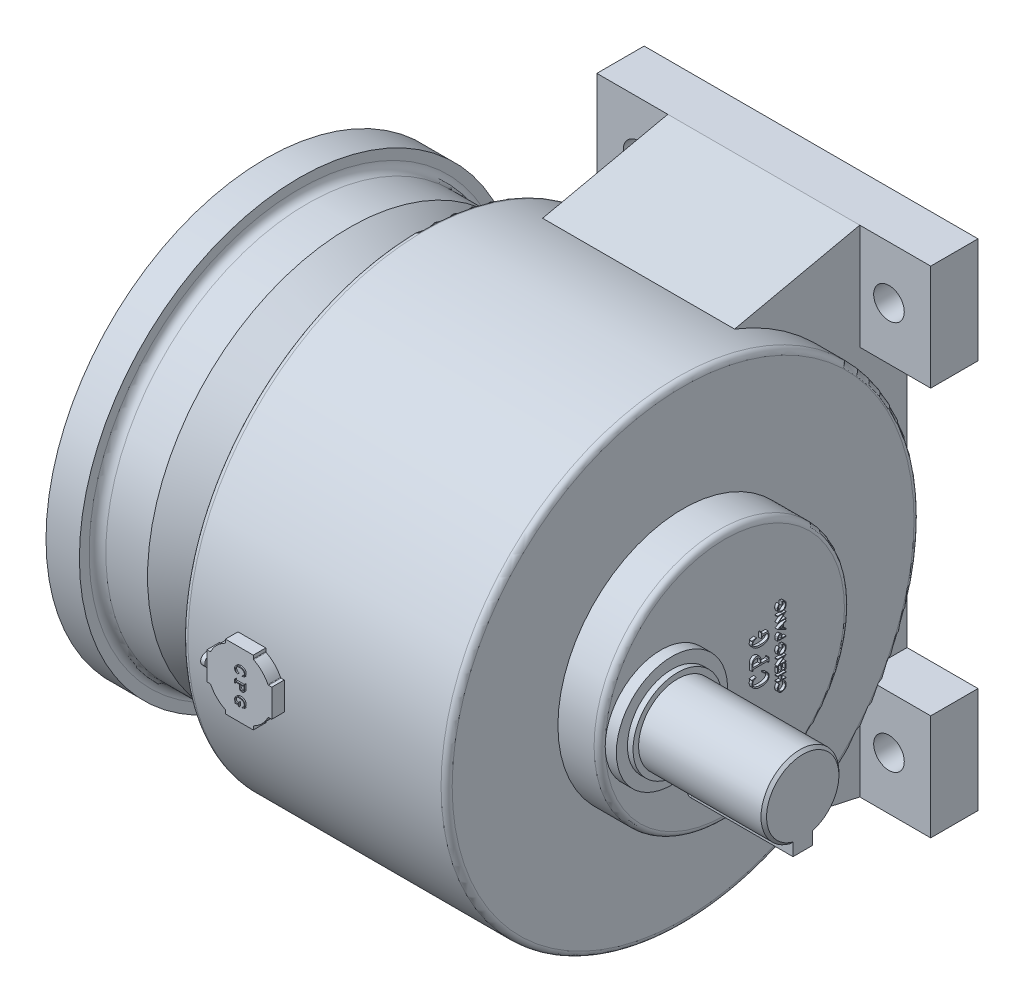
SolidWorks part; units mm, degrees
ref_plane "前视基准面" through (0, 0, 0) normal (0, 0, 1) x (1, 0, 0)
ref_plane "上视基准面" through (0, 0, 0) normal (0, 1, 0) x (1, 0, 0)
ref_plane "右视基准面" through (0, 0, 0) normal (1, 0, 0) x (0, 0, -1)
ref_plane "基准面1" through (0, 0, -116) normal (0, 0, 1) x (1, 0, 0)
sketch "草图1" plane through (0, 0, 0) normal (0, 1, 0) x (1, 0, 0)
  line L0 (0, 0) -> (33.1729, 0) construction
  line L1 (0, 0) -> (0, -14)
  line L2 (0, -14) -> (-45, -14)
  line L3 (-45, -14) -> (-45, -16)
  line L4 (-45, -16) -> (-47, -16)
  line L5 (-47, -16) -> (-47, -20)
  line L6 (-47, -20) -> (-51, -20)
  line L7 (-51, -20) -> (-51, 0)
  line L8 (-51, 0) -> (0, 0)
  dimension "D1" = 45
  dimension "D2" = 28
  dimension "D3" = 32
  dimension "D4" = 2
  dimension "D5" = 40
  dimension "D6" = 4
revolve "旋转1" add sketch "草图1" angle 360 about L0
sketch "草图2" plane through (0, 0, 0) normal (0, 1, 0) x (1, 0, 0)
  line L0 (8.0167, 23) -> (-51, 23) construction
  line L1 (-51, 23) -> (-51, -22)
  line L2 (-51, 20) -> (-51, -20) construction
  line L3 (-51, -22) -> (-66, -22)
  line L4 (-66, -22) -> (-66, -62)
  line L5 (-66, -62) -> (-161, -62)
  line L6 (-161, -62) -> (-161, 23)
  line L11 (-51, 23) -> (-161, 23)
  line L13 (-103.125, 116) -> (103.125, 116) construction
  dimension "D1" = 23
  dimension "D2" = 90
  dimension "D3" = 15
  dimension "D4" = 178
  dimension "D5" = 95
revolve "旋转2" add sketch "草图2" angle 360 about L0
sketch "草图3" plane through (0, 0, -116) normal (0, 0, 1) x (1, 0, 0)
  line L0 (0, 0) -> (40.0459, 0) construction
  line L1 (-173, -51) -> (-53, -51)
  line L2 (-173, -51) -> (-173, -89)
  line L3 (-173, -89) -> (-53, -89)
  line L4 (-53, -51) -> (-53, -89)
  line L5 (0, -14) -> (0, 14) construction
  circle A0 centre (-68, -70) radius 5.5
  circle A1 centre (-158, -70) radius 5.5
  dimension "D2" = 140
  dimension "D3" = 11
  dimension "D4" = 90
  dimension "D6" = 68
  dimension "D8" = 38
  dimension "D1" = 178
  dimension "D5" = 120
  dimension "D7" = 15
extrude "拉伸2" add sketch "草图3" along normal blind 17
mirror "镜向2" about plane through (0, 0, 0) normal (0, 1, 0)
ref_plane "基准面4" through (-113, 0, 0) normal (1, 0, 0) x (0, 0, -1)
sketch "草图4" plane through (-113, 0, 0) normal (1, 0, 0) x (0, 0, -1)
  line L0 (99, 51) -> (116, 51) construction
  line L1 (99, 51) -> (116, 51)
  line L2 (99, 89) -> (99, 51) construction
  line L3 (99, 89) -> (99, 51)
  line L4 (99, -51) -> (116, -51) construction
  line L5 (99, -51) -> (116, -51)
  line L6 (99, -89) -> (99, -51) construction
  line L7 (99, -89) -> (99, -51)
  line L8 (116, 51) -> (116, -51)
  line L9 (99, 89) -> (54, 79.1454)
  line L11 (54, -79.1454) -> (99, -89)
  arc A1 (54, -79.1454) -> (54, 79.1454) centre (23, 0) ccw
  circle A2 centre (23, 0) radius 85 construction
  dimension "D1" = 45
extrude "拉伸3" add sketch "草图4" against normal mid plane 69
sketch "草图5" plane through (0, 0, 0) normal (0, 1, 0) x (1, 0, 0)
  line L0 (0, -3.5) -> (-36.5, -3.5)
  line L1 (0, -14) -> (0, 14) construction
  line L2 (-36.5, 3.5) -> (0, 3.5)
  line L3 (0, 3.5) -> (0, -3.5)
  line L4 (31.1, -13.7955) -> (31.1, 19.6443) construction
  arc A0 (-36.5, -3.5) -> (-36.5, 3.5) centre (-36.5, 0) cw
  dimension "D2" = 40
  dimension "D1" = 7
  dimension "D3" = 31.1
extrude "拉伸4" add sketch "草图5" against normal blind 17.1
fillet "圆角1" radius 2 3 edges at (-161, 0, -108) (-66, 0, -108) (-51, 0, -68)
chamfer "倒角1" distance 1 angle 45 1 edges at (0, 14, 0)
sketch "草圖1" plane through (0, 0, 0) normal (0, 1, 0) x (1, 0, 0)
  line L0 (-161, 23) -> (-208.5, 23)
  line L1 (-161, -37) -> (-161, 23)
  line L2 (-80.3334, 23) -> (-252.5704, 23) construction
  line L4 (-161, -37) -> (-166, -37)
  line L5 (-166, -37) -> (-186, -49.5)
  line L6 (-186, -49.5) -> (-201, -49.5)
  line L7 (-204, -52.5) -> (-204, -56)
  line L8 (-204, -56) -> (-216, -56)
  line L9 (-216, -56) -> (-216, -33)
  line L10 (-215, -32) -> (-212, -32)
  line L11 (-212, -32) -> (-212, -27.0871)
  line L12 (-191, -16.5606) -> (-191, -11)
  line L13 (-194, -8) -> (-209, -8)
  line L14 (-210, -7) -> (-210, 2)
  line L15 (-210, 2) -> (-208.8, 2)
  line L16 (-208.5, 2.3) -> (-208.5, 23)
  line L17 (-211.9137, -26.988) -> (-191, -24.0869)
  arc A0 (-201, -49.5) -> (-204, -52.5) centre (-201, -52.5) ccw
  arc A1 (-191, -24.0869) -> (-189.7461, -19.0001) centre (-191.3875, -21.2934) ccw
  arc A2 (-215, -32) -> (-216, -33) centre (-215, -33) ccw
  arc A3 (-211.9137, -26.988) -> (-212, -27.0871) centre (-211.9, -27.0871) ccw
  arc A4 (-189.7461, -19.0001) -> (-191, -16.5606) centre (-188, -16.5606) cw
  arc A5 (-191, -11) -> (-194, -8) centre (-194, -11) ccw
  arc A6 (-209, -8) -> (-210, -7) centre (-209, -7) cw
  arc A7 (-208.8, 2) -> (-208.5, 2.3) centre (-208.8, 2.3) ccw
  point P27 (-216, -32)
  point P30 (-212, -27)
  point P33 (-191, -18.5)
  point P38 (-210, -8)
  point P41 (-210, 3)
  dimension "D9" = 158
  dimension "D19" = 23
  dimension "D20" = 216
  dimension "D7" = 55
  dimension "D8" = 145
  dimension "D10" = 110
  dimension "D11" = 4
  dimension "D16" = 6
revolve "旋轉1" add sketch "草圖1" angle 360 about L2
sketch "草圖2" plane through (-216, 0, 0) normal (-1, 0, 0) x (0, 0, 1)
  line L0 (-107.0945, 0) -> (65.8288, 0) construction
  line L1 (-23, 84.2191) -> (-23, -84.9666) construction
  circle A0 centre (-23, 0) radius 65 construction
  circle A1 centre (-68.9619, 45.9619) radius 4
  circle A2 centre (22.9619, 45.9619) radius 4
  circle A3 centre (22.9619, -45.9619) radius 4
  circle A4 centre (-68.9619, -45.9619) radius 4
  dimension "D1" = 130
  dimension "D2" = 8
extrude "伸長1" cut sketch "草圖2" against normal blind 25
sketch "草圖5" plane through (-216, 0, 0) normal (-1, 0, 0) x (0, 0, 1)
  line L0 (-23, 0) -> (-89.2638, 0) construction
  line L1 (-84.1334, 25.778) -> (-64.4295, 5.5251)
  line L2 (-84.1334, -25.2495) -> (-64.3656, -5.4747)
  line L3 (-63.4241, 10.7256) -> (-70.4952, 17.7967)
  line L4 (-40.7967, 47.4952) -> (-33.7256, 40.4241)
  line L5 (-69.7566, 35.0893) -> (-58.0893, 46.7566)
  line L6 (-48.778, 61.1334) -> (-29.0033, 41.3656)
  line L7 (2.2495, 61.1334) -> (-18.0034, 41.4295)
  line L8 (11.5607, 46.7566) -> (23.228, 35.0893)
  line L10 (23.9666, 17.7967) -> (16.8955, 10.7256)
  line L11 (37.6048, 25.778) -> (17.837, 6.0033)
  line L12 (37.6048, -25.2495) -> (17.9009, -4.9966)
  line L13 (23.228, -34.5607) -> (11.5607, -46.228)
  line L15 (-5.7319, -46.9666) -> (-12.803, -39.8955)
  line L16 (2.2495, -60.6048) -> (-17.5253, -40.837)
  line L17 (-48.778, -60.6048) -> (-28.5251, -40.9009)
  line L18 (-58.0893, -46.228) -> (-69.7566, -34.5607)
  line L20 (-70.4952, -17.2681) -> (-63.4241, -10.197)
  line L22 (-12.803, 40.4241) -> (-5.7319, 47.4952)
  line L24 (16.8955, -10.197) -> (23.9666, -17.2681)
  line L29 (-33.7256, -39.8955) -> (-40.7967, -46.9666)
  arc A0 (-84.1334, 25.778) -> (-84.1334, -25.2495) centre (-23.2643, 0.2643) ccw
  arc A1 (-33.7256, 40.4241) -> (-63.4241, 10.7256) centre (-23.2643, 0.2643) ccw
  arc A2 (16.8955, 10.7256) -> (-12.803, 40.4241) centre (-23.2643, 0.2643) ccw
  arc A3 (-64.4295, 5.5251) -> (-64.3656, -5.4747) centre (-23.2643, 0.2643) ccw
  arc A4 (2.2495, 61.1334) -> (-48.778, 61.1334) centre (-23.2643, 0.2643) ccw
  arc A5 (-18.0034, 41.4295) -> (-29.0033, 41.3656) centre (-23.2643, 0.2643) ccw
  arc A6 (-12.803, -39.8955) -> (16.8955, -10.197) centre (-23.2643, 0.2643) ccw
  arc A7 (37.6048, -25.2495) -> (37.6048, 25.778) centre (-23.2643, 0.2643) ccw
  arc A8 (17.9009, -4.9966) -> (17.837, 6.0033) centre (-23.2643, 0.2643) ccw
  arc A9 (-63.4241, -10.197) -> (-33.7256, -39.8955) centre (-23.2643, 0.2643) ccw
  arc A10 (-48.778, -60.6048) -> (2.2495, -60.6048) centre (-23.2643, 0.2643) ccw
  arc A11 (-28.5251, -40.9009) -> (-17.5253, -40.837) centre (-23.2643, 0.2643) ccw
  spline S0 degree 2 poles (-70.4952, 17.7967) (-75.3355, 26.6584) (-69.7566, 35.0893) knots 0 0 0 1 1 1
  spline S1 degree 2 poles (-40.7967, 47.4952) (-49.6584, 52.3355) (-58.0893, 46.7566) knots 0 0 0 1 1 1
  spline S2 degree 2 poles (23.9666, 17.7967) (28.807, 26.6584) (23.228, 35.0893) knots 0 0 0 1 1 1
  spline S3 degree 2 poles (-5.7319, 47.4952) (3.1298, 52.3355) (11.5607, 46.7566) knots 0 0 0 1 1 1
  spline S4 degree 2 poles (-5.7319, -46.9666) (3.1298, -51.807) (11.5607, -46.228) knots 0 0 0 1 1 1
  spline S5 degree 2 poles (23.9666, -17.2681) (28.807, -26.1298) (23.228, -34.5607) knots 0 0 0 1 1 1
  spline S6 degree 2 poles (-70.4952, -17.2681) (-75.3355, -26.1298) (-69.7566, -34.5607) knots 0 0 0 1 1 1
  spline S7 degree 2 poles (-40.7967, -46.9666) (-49.6584, -51.807) (-58.0893, -46.228) knots 0 0 0 1 1 1
extrude "伸長2" cut sketch "草圖5" against normal blind 39 draft 1
sketch "草圖7" plane through (-177, 0, 0) normal (-1, 0, 0) x (0, 0, 1)
  circle A0 centre (-23, 0) radius 51.5 construction
  circle A1 centre (-59.416, 36.416) radius 3
  circle A2 centre (13.416, 36.416) radius 3
  circle A3 centre (13.416, -36.416) radius 3
  circle A4 centre (-59.416, -36.416) radius 3
  dimension "D1" = 103
  dimension "D2" = 6
extrude "伸長6" cut sketch "草圖7" against normal blind 11
sketch "草圖8" plane through (-208.5, 0, 0) normal (-1, 0, 0) x (0, 0, 1)
  line L0 (-23, -16.5253) -> (-23, 16) construction
  line L3 (-40.7414, 0) -> (-6.4158, 0) construction
  line L5 (-15.7, 2) -> (-15.7, -2)
  line L6 (-15.7, -2) -> (-17.8765, -2)
  line L7 (-15.7, 2) -> (-17.8765, 2)
  circle A0 centre (-23, 0) radius 12.5
  arc A1 (-17.8765, 2) -> (-17.8765, -2) centre (-23, 0) ccw
  dimension "D1" = 25
  dimension "D2" = 11
  dimension "D3" = 7.3
  dimension "D4" = 4
extrude "伸長8" add sketch "草圖8" along normal blind 1
sketch "草圖9" plane through (-208.5, 0, 0) normal (-1, 0, 0) x (0, 0, 1)
  line L0 (-15.7, -2) -> (-15.7, 2) construction
  line L1 (-15.7, -2) -> (-15.7, 2)
  line L2 (-17.8765, -2) -> (-15.7, -2) construction
  line L3 (-15.7, 2) -> (-17.8765, 2) construction
  line L4 (-17.8765, -2) -> (-15.7, -2)
  line L5 (-15.7, 2) -> (-17.8765, 2)
  arc A0 (-17.8765, 2) -> (-17.8765, -2) centre (-23, 0) ccw construction
  arc A1 (-17.8765, 2) -> (-17.8765, -2) centre (-23, 0) ccw
extrude "伸長9" cut sketch "草圖9" against normal blind 28
sketch "草圖13"
extrude "伸長12" add sketch "草圖13" along normal blind 1
ref_plane "平面1" through (0, 0, 66.5) normal (0, 0, 1) x (1, 0, 0)
sketch "草圖10" plane through (0, 0, 66.5) normal (0, 0, 1) x (1, 0, 0)
  line L0 (-141, 11.65) -> (-131, 11.65)
  line L1 (-141, 11.65) -> (-141, 10.5119)
  line L2 (-131, 11.65) -> (-131, 10.5119)
  line L3 (-141, -10.5119) -> (-141, -11.65)
  line L4 (-131, -10.5119) -> (-131, -11.65)
  line L5 (-147.65, 5) -> (-146.5119, 5)
  line L6 (-147.65, -5) -> (-146.5119, -5)
  line L7 (-147.65, -5) -> (-147.65, 5)
  line L8 (-141, -11.65) -> (-141, -10.5119)
  line L9 (-131, -11.65) -> (-131, -10.5119)
  line L10 (-131, -11.65) -> (-141, -11.65)
  line L11 (-124.35, -5) -> (-125.4881, -5)
  line L12 (-124.35, 5) -> (-125.4881, 5)
  line L13 (-124.35, 5) -> (-124.35, -5)
  arc A0 (-141.1383, 10.2882) -> (-146.2882, 5.1383) centre (-136, 0) ccw
  arc A1 (-141.1383, 10.2882) -> (-141, 10.5119) centre (-141.25, 10.5119) ccw
  arc A2 (-131, 10.5119) -> (-130.8617, 10.2882) centre (-130.75, 10.5119) ccw
  arc A3 (-146.5119, 5) -> (-146.2882, 5.1383) centre (-146.5119, 5.25) ccw
  arc A4 (-146.2882, -5.1383) -> (-146.5119, -5) centre (-146.5119, -5.25) ccw
  arc A5 (-141, -10.5119) -> (-141.1383, -10.2882) centre (-141.25, -10.5119) ccw
  arc A6 (-130.8617, -10.2882) -> (-131, -10.5119) centre (-130.75, -10.5119) ccw
  arc A7 (-125.4881, -5) -> (-125.7118, -5.1383) centre (-125.4881, -5.25) ccw
  arc A8 (-125.7118, 5.1383) -> (-125.4881, 5) centre (-125.4881, 5.25) ccw
  arc A9 (-125.7118, 5.1383) -> (-130.8617, 10.2882) centre (-136, 0) ccw
  arc A10 (-146.2882, -5.1383) -> (-141.1383, -10.2882) centre (-136, 0) ccw
  arc A11 (-130.8617, -10.2882) -> (-125.7118, -5.1383) centre (-136, 0) ccw
  dimension "D1" = 11.5
extrude "伸長10" add sketch "草圖10" against normal blind 4.5 separate body contours A6 A11 A7 L11 L13 L12 A8 A9 A2 L2 L0 L1 A1 A0 A3 L5 L7 L6 A4 A10 A5 L3 L10 L4
sketch "草圖11"
extrude "伸長11" add sketch "草圖11" along normal blind 0.5
sketch "草圖12" plane through (0, 0, 0) normal (0, 1, 0) x (1, 0, 0)
  line L0 (-150.1623, -64.25) -> (-142.1623, -64.25)
  line L1 (-150.1623, -64.25) -> (-150.1623, -62.25)
  line L2 (-148.6623, -63) -> (-148.6623, -62.25)
  line L13 (-146.6623, -63) -> (-142.1623, -63.25)
  line L15 (-148.6623, -63) -> (-146.6623, -63)
  line L23 (-150.1623, -62.25) -> (-148.6623, -62.25)
  line L24 (-146.6623, -64.25) -> (-146.6623, -63)
  line L25 (-142.1623, -64.25) -> (-142.1623, -63.25)
revolve "旋轉2" add sketch "草圖12" angle 360 about L0
equation "\"D7@草图3\"=(\"D5@草图3\"-\"D4@草图3\")/2"
equation "\"D8@草图3\"=\"D1@草图3\"-\"D2@草图3\""
equation "\"D1@拉伸4\"=\"D3@草图5\"-\"D2@草图1\"/2"
equation "\"D3@草图1\"=\"D2@草图1\"+4"
equation "\"D5@草图2\" = \"D5@草图3\"-25"
equation "\"D1@基准面4\" = \"D5@草图3\"/2"
equation "\"D1@拉伸3\" = \"D4@草图3\"-\"D3@草图3\"-10"
